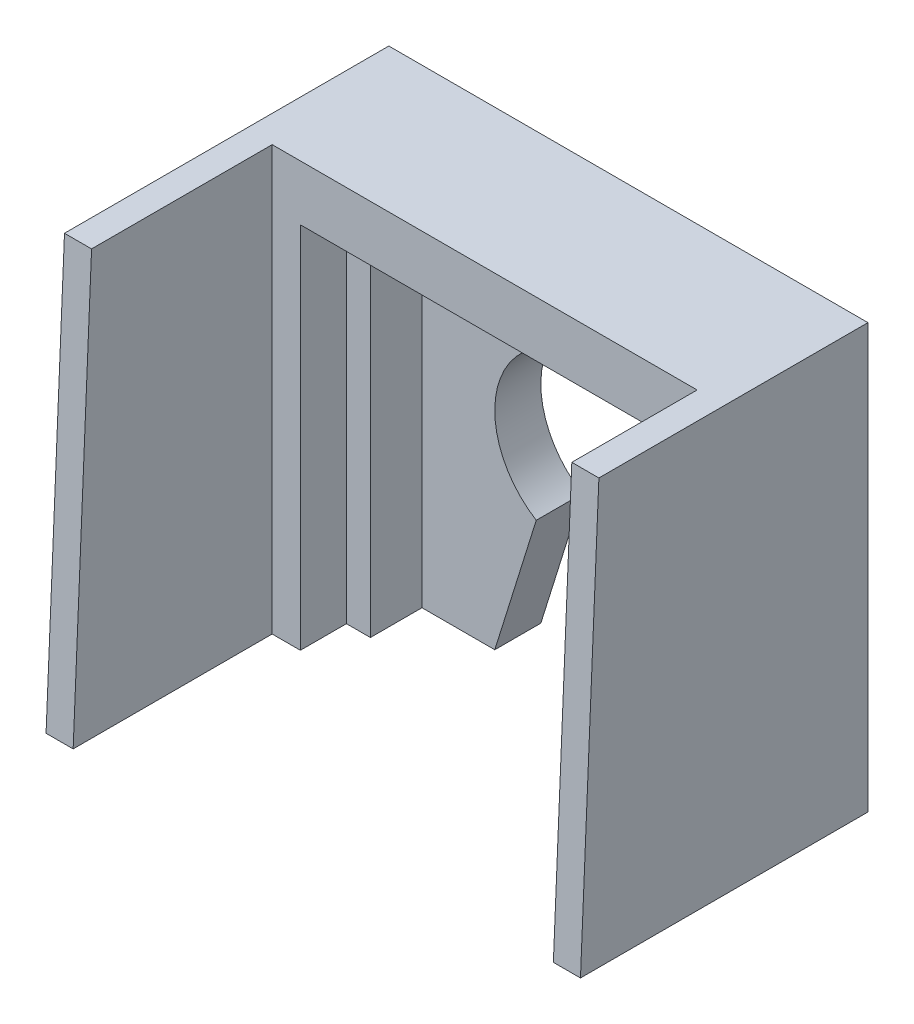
SolidWorks part; units mm, degrees
ref_plane "Front Plane" through (0, 0, 0) normal (0, 0, 1) x (1, 0, 0)
ref_plane "Top Plane" through (0, 0, 0) normal (0, 1, 0) x (1, 0, 0)
ref_plane "Right Plane" through (0, 0, 0) normal (1, 0, 0) x (0, 0, -1)
sketch "Sketch1" plane through (0, 0, 0) normal (0, 0, 1) x (1, 0, 0)
  line L0 (-10, 8.75) -> (10, 8.75)
  line L1 (0, 0) -> (0, 4.75) construction
  line L2 (-4.75, 0) -> (4.75, 0) construction
  line L3 (-10, 8.75) -> (-10, -11.25)
  line L4 (-10, -11.25) -> (-4.75, -11.25)
  line L5 (-4.75, -11.25) -> (-2.5, -4.0389)
  line L6 (10, 8.75) -> (10, -11.25)
  line L7 (10, -11.25) -> (4.75, -11.25)
  line L8 (4.75, -11.25) -> (2.5, -4.0389)
  arc A0 (2.5, -4.0389) -> (-2.5, -4.0389) centre (0, 0) ccw
  point P6 (0, 8.75)
  dimension "D1" = 4.75
  dimension "D3" = 4
  dimension "D2" = 5
  dimension "D4" = 20
  dimension "D5" = 20
extrude "Extrude1" add sketch "Sketch1" along normal blind 2.5
sketch "Sketch2" plane through (0, 0, 0) normal (0, 0, 1) x (1, 0, 0)
  line L0 (10, -11.25) -> (10, 8.75) construction
  line L1 (10, 8.75) -> (-10, 8.75) construction
  line L2 (-10, 8.75) -> (-10, -11.25) construction
  line L3 (10, -11.25) -> (10, 8.75)
  line L4 (10, 8.75) -> (-10, 8.75)
  line L5 (-10, 8.75) -> (-10, -11.25)
  line L6 (-10, -11.25) -> (-13, -11.25)
  line L7 (-13, -11.25) -> (-13, 11.75)
  line L8 (-13, 11.75) -> (13, 11.75)
  line L9 (13, 11.75) -> (13, -11.25)
  line L10 (13, -11.25) -> (10, -11.25)
  dimension "D1" = 3
  dimension "D2" = 3
extrude "Extrude2" add sketch "Sketch2" along normal blind 7.8
sketch "Sketch3" plane through (0, 0, 2.5) normal (0, 0, 1) x (1, 0, 0)
  line L0 (10, 8.75) -> (-10, 8.75) construction
  line L1 (-10, -11.25) -> (-8.7, -11.25)
  line L2 (-10, -11.25) -> (-10, 8.75)
  line L3 (-10, 8.75) -> (-8.7, 8.75)
  line L4 (-8.7, -11.25) -> (-8.7, 8.75)
  line L5 (4.75, -11.25) -> (10, -11.25) construction
  line L6 (10, 8.75) -> (8.7, 8.75)
  line L7 (10, 8.75) -> (10, -11.25)
  line L8 (10, -11.25) -> (8.7, -11.25)
  line L9 (8.7, 8.75) -> (8.7, -11.25)
  dimension "D1" = 1.3
extrude "Extrude3" add sketch "Sketch3" along normal blind 2.8
sketch "Sketch4" plane through (0, 0, 7.8) normal (0, 0, 1) x (1, 0, 0)
  line L0 (-13, -11.25) -> (-10, -11.25) construction
  line L1 (-13, 11.75) -> (-11.53, 11.75)
  line L2 (-13, 11.75) -> (-13, -11.25)
  line L3 (-13, -11.25) -> (-11.53, -11.25)
  line L4 (-11.53, 11.75) -> (-11.53, -11.25)
  line L6 (13, 11.75) -> (11.53, 11.75)
  line L7 (13, 11.75) -> (13, -11.25)
  line L8 (13, -11.25) -> (11.53, -11.25)
  line L9 (11.53, 11.75) -> (11.53, -11.25)
  dimension "D1" = 1.47
extrude "Extrude4" add sketch "Sketch4" along normal blind 10.8
sketch "Sketch5" plane through (13, 0, 0) normal (1, 0, 0) x (0, 0, -1)
  line L0 (-18.6, -11.25) -> (-18.6, 11.75) construction
  line L2 (-18.6, -11.25) -> (-18.6, 11.75)
  line L3 (-18.6, 11.75) -> (-14.6, 11.75)
  line L4 (-18.6, 11.75) -> (0, 11.75) construction
  line L5 (-14.6, 11.75) -> (-15.6, -11.25)
  line L6 (-18.6, -11.25) -> (0, -11.25) construction
  line L7 (-15.6, -11.25) -> (-18.6, -11.25)
  dimension "D1" = 3
  dimension "D2" = 4
extrude "Cut-Extrude1" cut sketch "Sketch5" against normal up to surface (1.47 mm away)
sketch "Sketch6" plane through (-13, 0, 0) normal (-1, 0, 0) x (0, 0, 1)
  line L0 (18.6, 11.75) -> (18.6, -11.25) construction
  line L1 (18.6, 11.75) -> (18.6, -11.25)
  line L2 (18.6, 11.75) -> (17.6, 11.75)
  line L3 (18.6, 11.75) -> (0, 11.75) construction
  line L4 (17.6, 11.75) -> (18.6, -11.25)
  dimension "D1" = 1
extrude "Cut-Extrude2" cut sketch "Sketch6" against normal up to surface (1.47 mm away)
